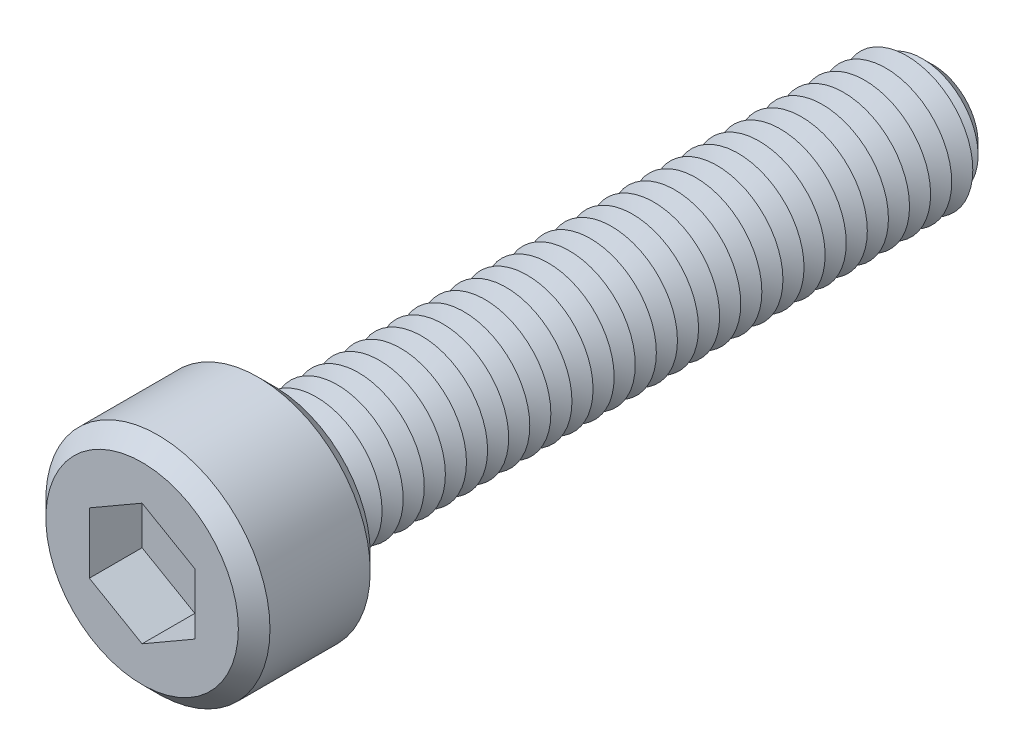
SolidWorks part; units mm, degrees
ref_plane "Front Plane" through (0, 0, 0) normal (0, 0, 1) x (1, 0, 0)
ref_plane "Top Plane" through (0, 0, 0) normal (0, 1, 0) x (1, 0, 0)
ref_plane "Right Plane" through (0, 0, 0) normal (1, 0, 0) x (0, 0, -1)
sketch "Sketch1" plane through (0, 0, 0) normal (0, 0, 1) x (1, 0, 0)
  circle A0 centre (0, 0) radius 4.25
  dimension "D1" = 8.5
extrude "Boss-Extrude1" add sketch "Sketch1" along normal blind 5
sketch "Sketch2" plane through (0, 0, 0) normal (0, 0, -1) x (-1, 0, 0)
  circle A0 centre (0, 0) radius 2.5
  dimension "D1" = 5
extrude "Boss-Extrude2" add sketch "Sketch2" along normal blind 25
chamfer "Chamfer1" distance 0.8 angle 45 1 edges at (-2.5, 0, -25)
sketch "Sketch3" plane through (0, 0, 0) normal (1, 0, 0) x (0, 0, -1)
  line L0 (-2.5121, 0) -> (4.5776, 0) construction
sketch "Sketch4" plane through (0, 0, 0) normal (1, 0, 0) x (0, 0, -1)
  line L0 (0, 2.5) -> (0.4, 1.8072)
  line L1 (0.4, 1.8072) -> (0.8, 2.5)
  line L2 (24.2, 2.5) -> (0, 2.5) construction
  line L3 (0.8, 2.5) -> (0, 2.5)
  dimension "D1" = 0.8
revolve "Cut-Revolve1" cut sketch "Sketch4" angle 360 about L0
pattern_linear "LPattern1" count 31 spacing 0.8 along (0, 0, -1) of "Cut-Revolve1"
sketch "Sketch5" plane through (0, 0, 5) normal (0, 0, 1) x (1, 0, 0)
  line L1 (0, 2.3094) -> (-2, 1.1547)
  line L2 (-2, 1.1547) -> (-2, -1.1547)
  line L3 (-2, -1.1547) -> (0, -2.3094)
  line L4 (0, -2.3094) -> (2, -1.1547)
  line L5 (2, -1.1547) -> (2, 1.1547)
  line L6 (2, 1.1547) -> (0, 2.3094)
  circle A0 centre (0, 0) radius 2 construction
  dimension "D1" = 4
extrude "Cut-Extrude1" cut sketch "Sketch5" against normal blind 2
sketch "Sketch6" plane through (0, 0, 3) normal (0, 0, 1) x (1, 0, 0)
  circle A0 centre (0, 0) radius 0.65
  dimension "D1" = 1.3
extrude "Cut-Extrude2" cut sketch "Sketch6" against normal up to surface (28 mm away)
chamfer "Chamfer2" distance 0.6 angle 45 2 edges at (4.25, 0, 0) (4.25, 0, 5)
